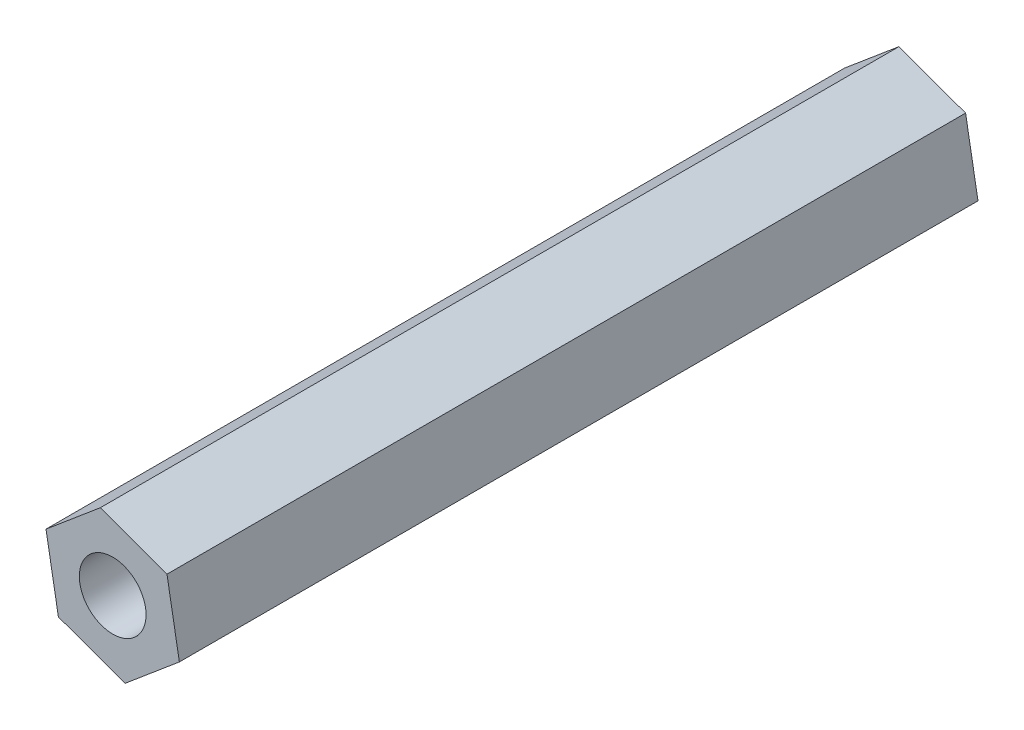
SolidWorks part; units mm, degrees
ref_plane "Front Plane" through (0, 0, 0) normal (0, 0, 1) x (1, 0, 0)
ref_plane "Top Plane" through (0, 0, 0) normal (0, 1, 0) x (1, 0, 0)
ref_plane "Right Plane" through (0, 0, 0) normal (1, 0, 0) x (0, 0, -1)
sketch "Sketch1" plane through (0, 0, 0) normal (0, 0, 1) x (1, 0, 0)
  line L1 (3.4465, -1.25) -> (2.8058, 2.3597)
  line L2 (2.8058, 2.3597) -> (-0.6407, 3.6098)
  line L3 (-0.6407, 3.6098) -> (-3.4465, 1.25)
  line L4 (-3.4465, 1.25) -> (-2.8058, -2.3597)
  line L5 (-2.8058, -2.3597) -> (0.6407, -3.6098)
  line L6 (0.6407, -3.6098) -> (3.4465, -1.25)
  circle A0 centre (0, 0) radius 3.175 construction
  dimension "D1" = 6.35
extrude "Boss-Extrude1" add sketch "Sketch1" along normal blind 41.275
sketch "Sketch2" plane through (0, 0, 41.275) normal (0, 0, 1) x (1, 0, 0)
  circle A0 centre (0, 0) radius 1.7242
extrude "Cut-Extrude1" cut sketch "Sketch2" against normal through all
